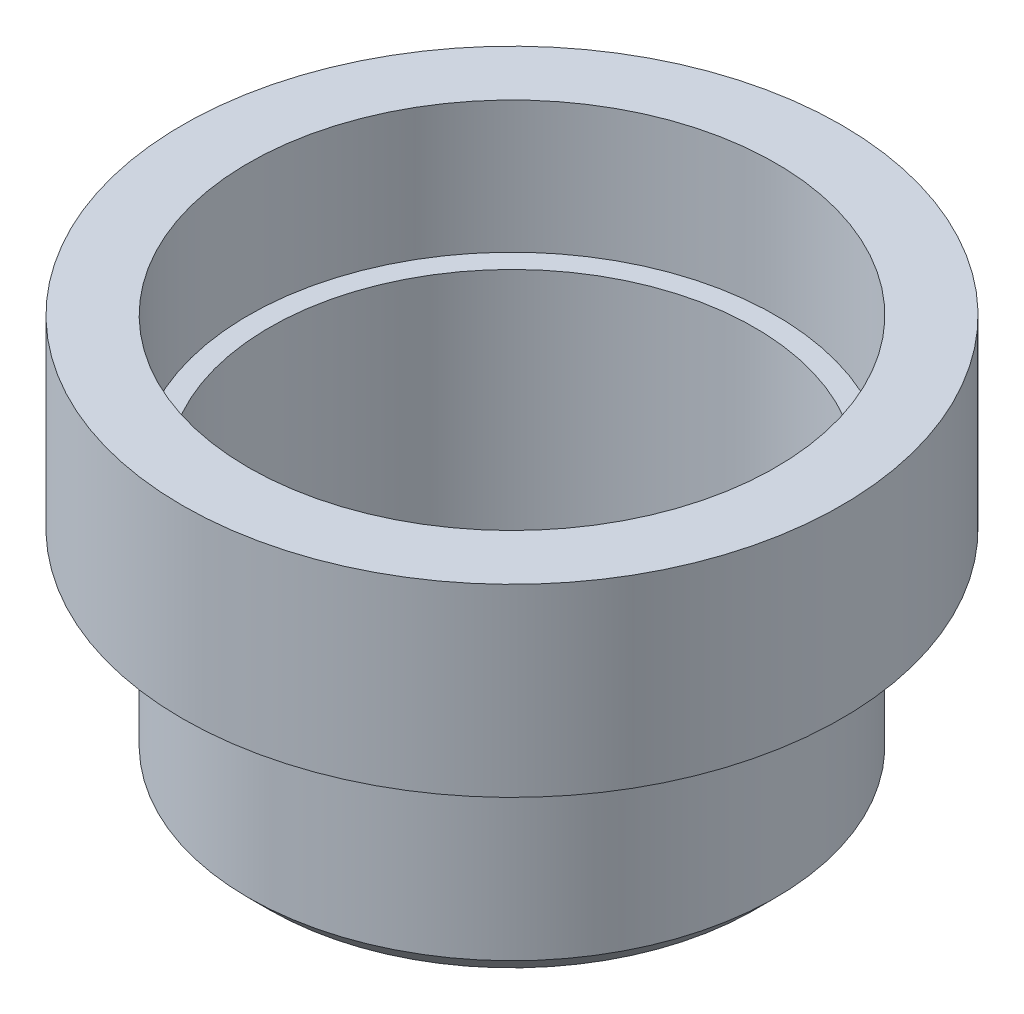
SolidWorks part; units mm, degrees
ref_plane "Front Plane" through (0, 0, 0) normal (0, 0, 1) x (1, 0, 0)
ref_plane "Top Plane" through (0, 0, 0) normal (0, 1, 0) x (1, 0, 0)
ref_plane "Right Plane" through (0, 0, 0) normal (1, 0, 0) x (0, 0, -1)
sketch "Sketch1" plane through (0, 0, 0) normal (0, 1, 0) x (1, 0, 0)
  circle A0 centre (0, 0) radius 15.875
  dimension "D1" = 31.75
extrude "Boss-Extrude1" add sketch "Sketch1" along normal blind 19.05
sketch "Sketch2" plane through (0, 19.05, 0) normal (0, 1, 0) x (1, 0, 0)
  circle A0 centre (0, 0) radius 2159
  circle A2 centre (0, 0) radius 11.684
  circle A4 centre (0, 0) radius 15.875 construction
  dimension "D1" = 4.191
extrude "Cut-Extrude1" cut sketch "Sketch2" against normal through all contours A2
sketch "Sketch3" plane through (0, 19.05, 0) normal (0, 1, 0) x (1, 0, 0)
  circle A0 centre (0, 0) radius 12.7
extrude "Cut-Extrude2" cut sketch "Sketch3" against normal blind 6.35
other "1-14 Machine Threads Stud1" parameters "D1"=25.4, "D2"=10, "D3"=10.16, "D4"=31.75
sketch "Sketch4" plane through (0, 0, 0) normal (1, 0, 0) x (0, 0, 1)
  line L5 (0, -14.3089) -> (0, 0) construction
  line L6 (11.5976, 0) -> (12.7, -1.1024)
  line L9 (12.7, -1.1024) -> (12.7, -10.16)
  line L10 (11.5976, 0) -> (15.875, 0)
  line L11 (15.875, 0) -> (15.875, -10.16)
  line L12 (12.7, -10.16) -> (15.875, -10.16)
  point P2 (0, 0)
  point P4 (0, 0)
  point P8 (0, 0)
  point P9 (0, 0)
  point P11 (8.8985, 1.1015)
  point P12 (0, 0)
  point P13 (8.8985, -2.3157)
  point P14 (10, 0)
  dimension "Minor Diameter" = 23.1953
  dimension "Major Diameter" = 25.4
  dimension "Thread Length" = 10.16
  dimension "Cylinder Diameter" = 31.75
  dimension "Chamfer Angle" = 45
